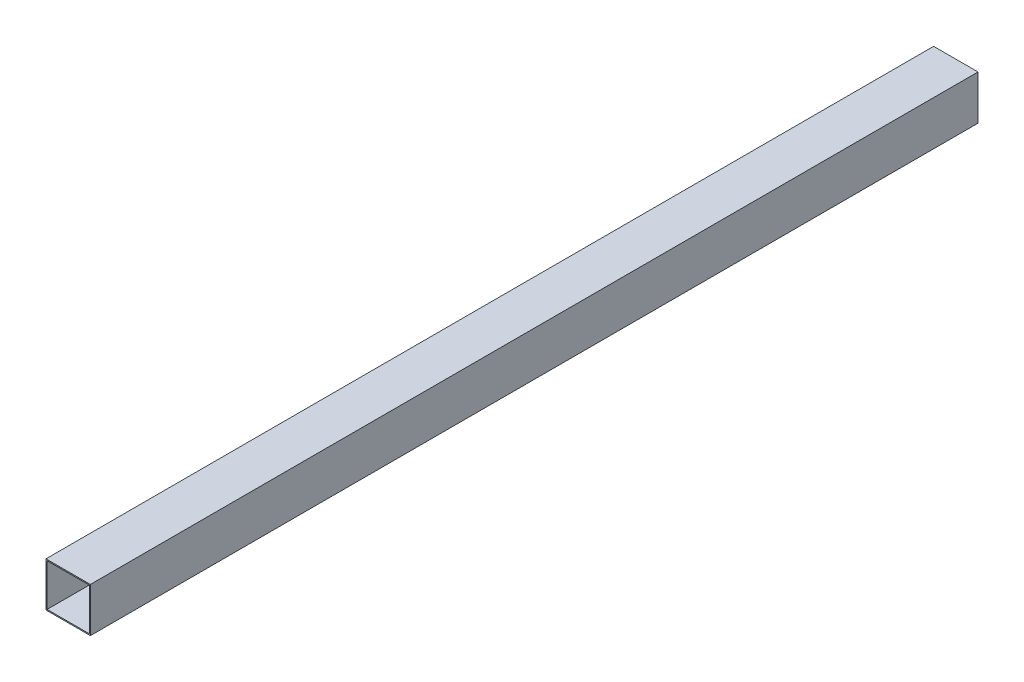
SolidWorks part; units mm, degrees
ref_plane "Piano frontale" through (0, 0, 0) normal (0, 0, 1) x (1, 0, 0)
ref_plane "Piano superiore" through (0, 0, 0) normal (0, 1, 0) x (1, 0, 0)
ref_plane "Piano destro" through (0, 0, 0) normal (1, 0, 0) x (0, 0, -1)
sketch "Schizzo1" plane through (0, 0, 0) normal (0, 0, 1) x (1, 0, 0)
  line L1 (-20, -20) -> (20, -20)
  line L2 (-20, -20) -> (-20, 20)
  line L3 (-20, 20) -> (20, 20)
  line L4 (20, -20) -> (20, 20)
  line L5 (-20, -20) -> (20, 20) construction
  line L6 (-20, 20) -> (20, -20) construction
  point P0 (0, 0)
  dimension "D1" = 40
  dimension "D2" = 40
extrude "Estrusione-Sottile1" add sketch "Schizzo1" along normal blind 800 thin
